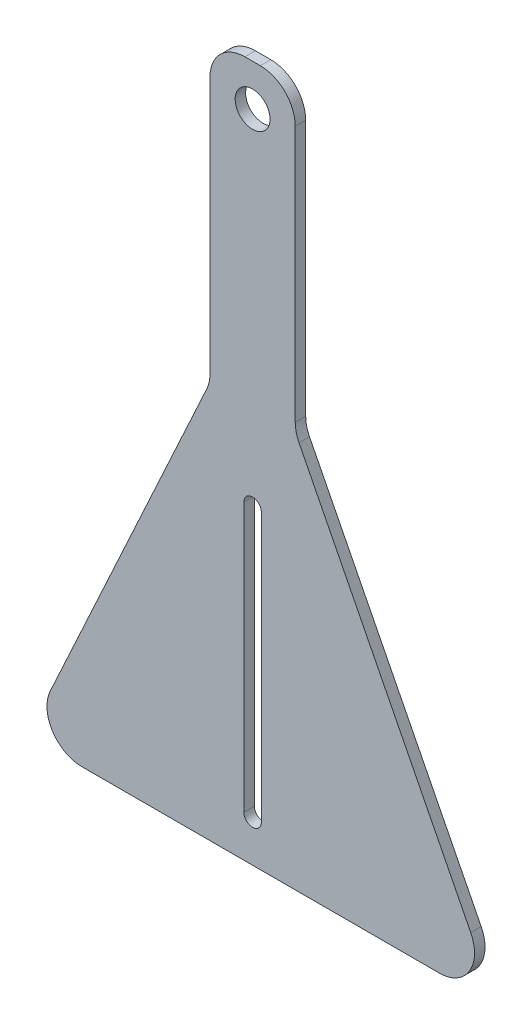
SolidWorks part; units mm, degrees
ref_plane "Front" through (0, 0, 0) normal (0, 0, 1) x (1, 0, 0)
ref_plane "Top" through (0, 0, 0) normal (0, 1, 0) x (1, 0, 0)
ref_plane "Right" through (0, 0, 0) normal (1, 0, 0) x (0, 0, -1)
sketch "Sketch1" plane through (0, 0, 0) normal (0, 0, 1) x (1, 0, 0)
  line L0 (-12.2068, 0) -> (12.2068, 0) construction
  line L1 (-2.2068, 11.8941) -> (2.2068, 11.8941)
  line L2 (-12.2068, 1.8941) -> (-12.2068, -71.7419)
  line L4 (12.2068, 1.8941) -> (12.2068, -71.5413)
  line L5 (13.2894, -76.0668) -> (62.4691, -172.975)
  line L6 (-2.5, -98.6712) -> (-2.5, -175.6017)
  line L7 (53.5517, -187.5005) -> (-48.8841, -187.5005)
  line L8 (2.5, -98.6712) -> (2.5, -175.6017)
  line L9 (-57.9675, -173.3181) -> (-13.1234, -75.9243)
  circle A0 centre (0, 0) radius 5
  arc A1 (-2.5, -98.6712) -> (2.5, -98.6712) centre (0, -98.6712) cw
  arc A2 (-2.5, -175.6017) -> (2.5, -175.6017) centre (0, -175.6017) ccw
  arc A3 (12.2068, 1.8941) -> (2.2068, 11.8941) centre (2.2068, 1.8941) ccw
  arc A4 (-12.2068, 1.8941) -> (-2.2068, 11.8941) centre (-2.2068, 1.8941) cw
  arc A5 (53.5517, -187.5005) -> (62.4691, -172.975) centre (53.5517, -177.5005) ccw
  arc A6 (-57.9675, -173.3181) -> (-48.8841, -187.5005) centre (-48.8841, -177.5005) ccw
  arc A7 (-12.2068, -71.7419) -> (-13.1234, -75.9243) centre (-22.2068, -71.7419) cw
  arc A8 (12.2068, -71.5413) -> (13.2894, -76.0668) centre (22.2068, -71.5413) ccw
  dimension "D2" = 10
  dimension "D3" = 10
  dimension "D4" = 10
  dimension "D1" = 5
extrude "Base-Extrude" add sketch "Sketch1" along normal blind 3
